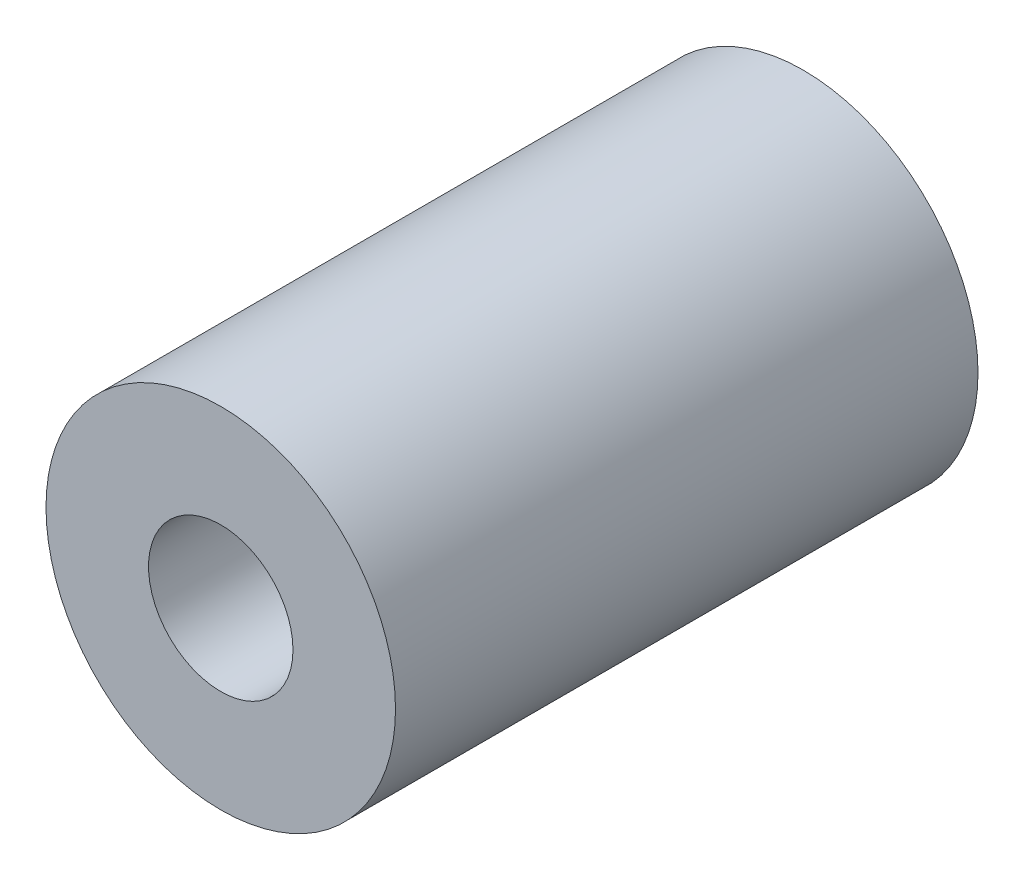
SolidWorks part; units mm, degrees
ref_plane "前视基准面" through (0, 0, 0) normal (0, 0, 1) x (1, 0, 0)
ref_plane "上视基准面" through (0, 0, 0) normal (0, 1, 0) x (1, 0, 0)
ref_plane "右视基准面" through (0, 0, 0) normal (1, 0, 0) x (0, 0, -1)
sketch "草图1" plane through (0, 0, 0) normal (0, 0, 1) x (1, 0, 0)
  circle A0 centre (0, 0) radius 7.5
  dimension "D1" = 15
extrude "凸台-拉伸1" add sketch "草图1" along normal blind 25
sketch "草图2" plane through (0, 0, 25) normal (0, 0, 1) x (1, 0, 0)
  circle A0 centre (0, 0) radius 3.1
extrude "切除-拉伸1" cut sketch "草图2" against normal blind 25
